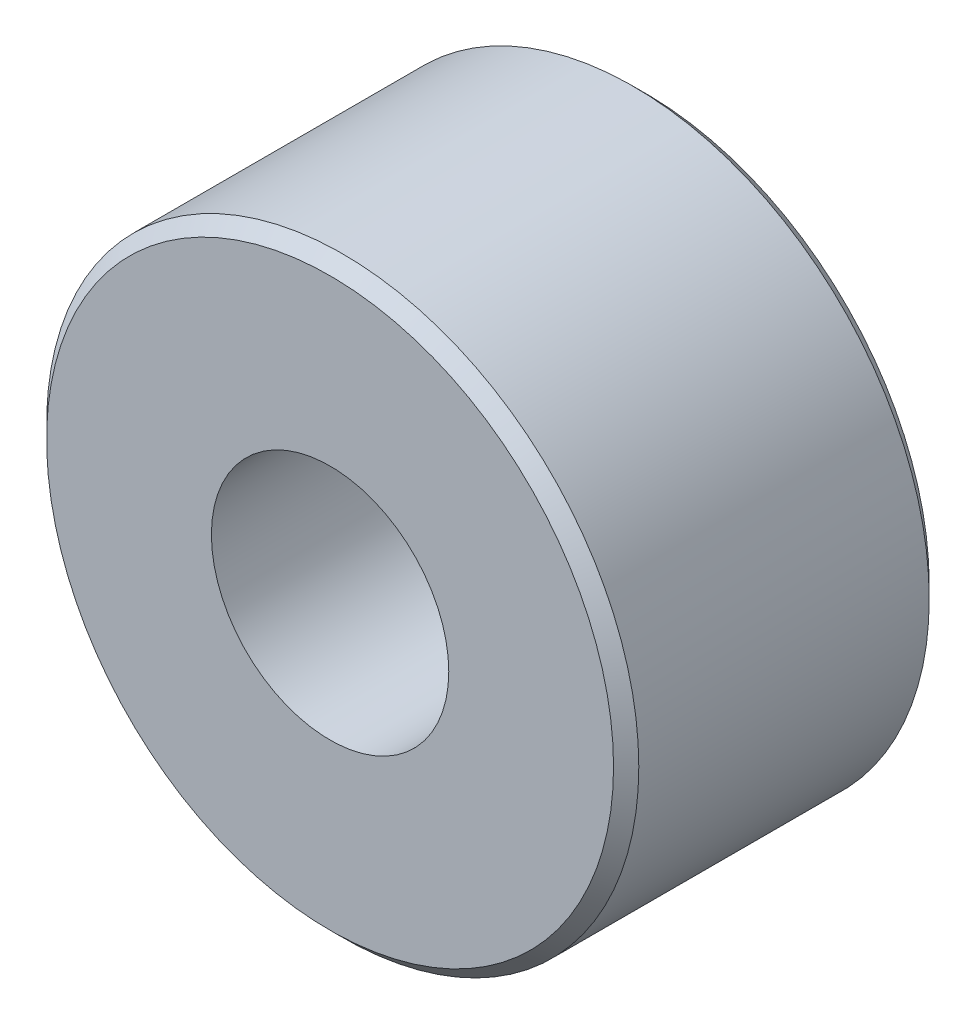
SolidWorks part; units mm, degrees
ref_plane "Front Plane" through (0, 0, 0) normal (0, 0, 1) x (1, 0, 0)
ref_plane "Top Plane" through (0, 0, 0) normal (0, 1, 0) x (1, 0, 0)
ref_plane "Right Plane" through (0, 0, 0) normal (1, 0, 0) x (0, 0, -1)
sketch "Sketch1" plane through (0, 0, 0) normal (0, 0, 1) x (1, 0, 0)
  circle A0 centre (0, 0) radius 5.9563
  dimension "D1" = 11.9126
extrude "Boss-Extrude1" add sketch "Sketch1" along normal mid plane 6.35
sketch "Sketch2" plane through (0, 0, 3.175) normal (0, 0, 1) x (1, 0, 0)
  circle A0 centre (0, 0) radius 2.3876
  dimension "D1" = 4.7752
extrude "Cut-Extrude1" cut sketch "Sketch2" against normal through all
chamfer "Chamfer1" distance 0.254 angle 45 2 edges at (5.9563, 0, -3.175) (5.9563, 0, 3.175)
